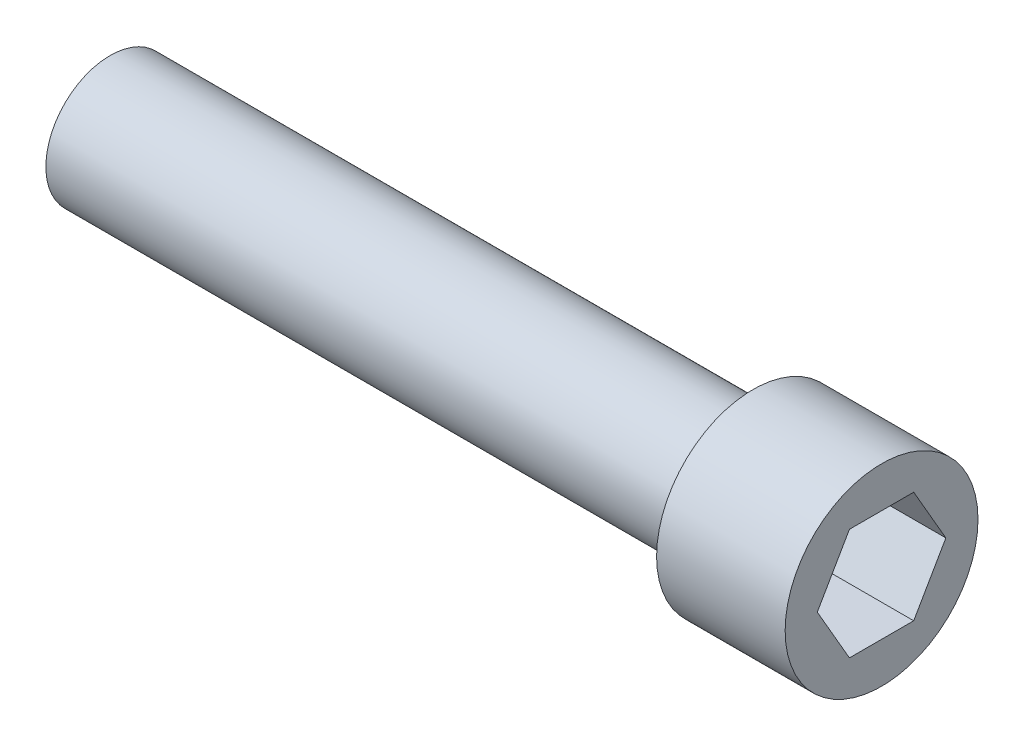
SolidWorks part; units mm, degrees
ref_plane "Front Plane" through (0, 0, 0) normal (0, 0, 1) x (1, 0, 0)
ref_plane "Top Plane" through (0, 0, 0) normal (0, 1, 0) x (1, 0, 0)
ref_plane "Right Plane" through (0, 0, 0) normal (1, 0, 0) x (0, 0, -1)
sketch "Sketch1" plane through (0, 0, 0) normal (1, 0, 0) x (0, 0, -1)
  circle A0 centre (0, 0) radius 1
  dimension "D1" = 2
extrude "Boss-Extrude1" add sketch "Sketch1" along normal blind 10
sketch "Sketch2" plane through (10, 0, 0) normal (1, 0, 0) x (0, 0, -1)
  circle A0 centre (0, 0) radius 1.5
  dimension "D1" = 3
extrude "Boss-Extrude2" add sketch "Sketch2" along normal blind 2
sketch "Sketch3" plane through (12, 0, 0) normal (1, 0, 0) x (0, 0, -1)
  line L1 (-1, 0) -> (-0.5, -0.866)
  line L2 (-0.5, -0.866) -> (0.5, -0.866)
  line L3 (0.5, -0.866) -> (1, 0)
  line L4 (1, 0) -> (0.5, 0.866)
  line L5 (0.5, 0.866) -> (-0.5, 0.866)
  line L6 (-0.5, 0.866) -> (-1, 0)
  circle A0 centre (0, 0) radius 0.866 construction
  dimension "D1" = 2
extrude "Cut-Extrude1" cut sketch "Sketch3" against normal blind 1.5
